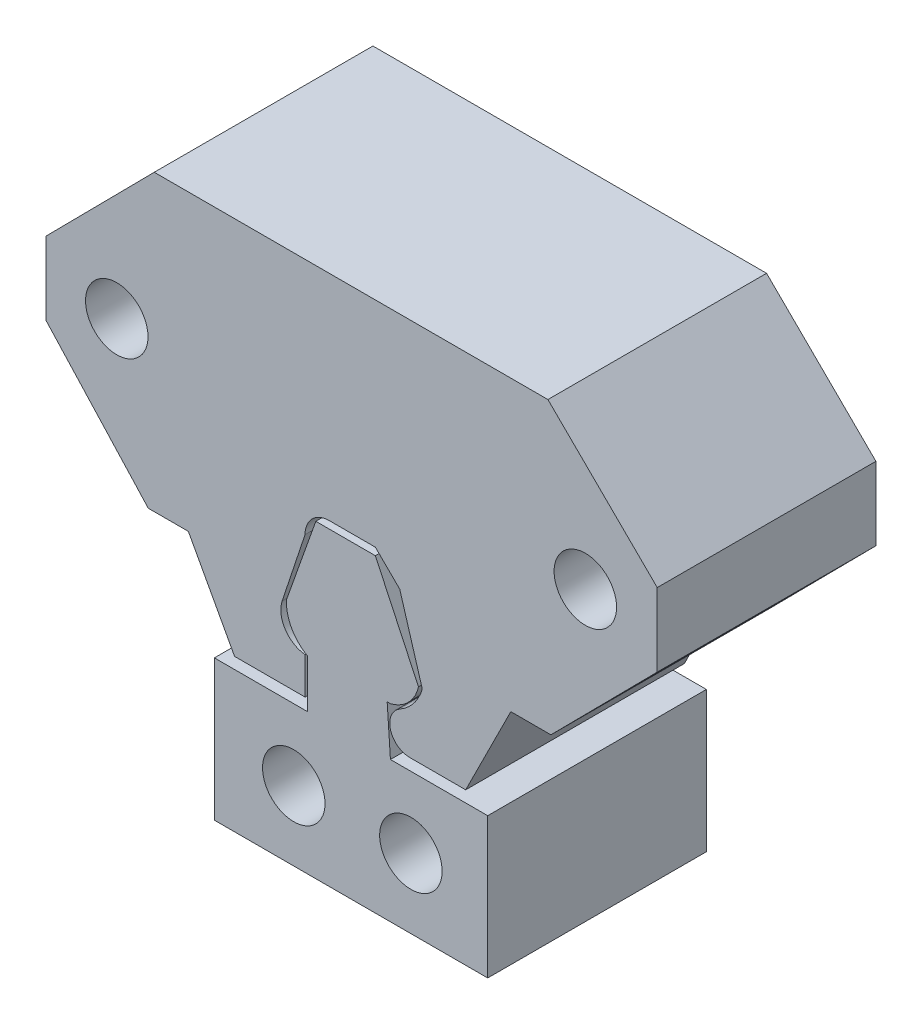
SolidWorks part; units mm, degrees
ref_plane "Front Plane" through (0, 0, 0) normal (0, 0, 1) x (1, 0, 0)
ref_plane "Top Plane" through (0, 0, 0) normal (0, 1, 0) x (1, 0, 0)
ref_plane "Right Plane" through (0, 0, 0) normal (1, 0, 0) x (0, 0, -1)
sketch "Sketch1" plane through (0, 0, 0) normal (0, 0, 1) x (1, 0, 0)
  line L0 (122.555, 198.3887) -> (200.555, 198.3887) construction
  line L1 (186.3841, 213.1351) -> (186.3841, 145.1351) construction
  line L3 (186.7465, 212.7767) -> (200.7465, 198.9271)
  line L4 (200.7465, 198.9271) -> (200.7465, 189.5559)
  line L5 (200.7465, 189.5559) -> (187.1301, 175.7916)
  line L6 (187.1301, 175.7916) -> (181.9968, 175.7916)
  line L7 (181.9968, 175.7916) -> (176.2207, 164.2339)
  line L8 (176.2207, 164.2339) -> (169.0289, 164.2339)
  line L9 (170.6634, 172.6244) -> (167.7718, 182.2703)
  line L10 (167.7718, 182.2703) -> (164.6535, 185.3551)
  line L11 (164.6535, 185.3551) -> (158.7543, 185.3551)
  line L12 (155.6512, 182.253) -> (152.7199, 173.4253)
  line L13 (154.2027, 164.2339) -> (146.6276, 164.2339)
  line L14 (146.6276, 164.2339) -> (140.7091, 175.1351)
  line L15 (155.6666, 168.9446) -> (155.6666, 164.2339)
  line L16 (155.6666, 162.7767) -> (144.0394, 162.7767)
  line L17 (144.0394, 162.7767) -> (144.0394, 144.7767)
  line L18 (144.0394, 144.7767) -> (179.0394, 144.7767)
  line L19 (179.0394, 144.7767) -> (179.0394, 162.7767)
  line L20 (179.0394, 162.7767) -> (166.582, 162.7767)
  line L21 (136.3402, 212.7767) -> (122.4906, 198.7767)
  line L22 (122.4906, 198.7767) -> (122.4906, 189.4054)
  line L23 (122.4906, 189.4054) -> (135.5757, 175.1351)
  line L24 (135.5757, 175.1351) -> (140.7091, 175.1351)
  line L25 (131.5394, 194.1351) -> (191.5394, 194.1351) construction
  line L27 (155.6666, 162.7767) -> (155.9626, 162.7767)
  line L29 (136.3402, 212.7767) -> (186.7465, 212.7767)
  line L30 (154.2027, 164.2339) -> (155.6666, 164.2339)
  line L31 (155.9626, 162.7767) -> (155.9626, 168.9446)
  line L32 (153.2635, 173.818) -> (157.026, 184.4131)
  line L33 (157.026, 184.4131) -> (164.6535, 184.4131)
  line L34 (164.6535, 184.4131) -> (170.1746, 172.6244)
  line L35 (166.582, 168.9633) -> (166.1647, 168.9633)
  line L36 (166.1647, 168.9633) -> (166.582, 162.7767)
  circle A0 centre (131.5394, 194.1351) radius 4
  arc A1 (169.0289, 164.2339) -> (167.7718, 168.9633) centre (169.0289, 166.7656) cw
  arc A2 (167.7718, 168.9633) -> (170.6634, 172.6244) centre (164.6707, 174.385) ccw
  arc A3 (158.7543, 185.3551) -> (155.6512, 182.253) centre (158.7543, 182.252) ccw
  arc A4 (152.7199, 173.4253) -> (155.6666, 168.9446) centre (155.9626, 172.3486) ccw
  circle A6 centre (191.5394, 194.1351) radius 4
  circle A7 centre (154.2027, 153.6868) radius 4
  circle A8 centre (169.2027, 153.6868) radius 4
  arc A9 (155.9626, 168.9446) -> (153.2635, 173.818) centre (158.6151, 173.5978) cw
  arc A10 (170.1746, 172.6244) -> (166.582, 168.9633) centre (165.3933, 173.723) cw
  point P42 (161.5394, 194.1351)
  point P43 (161.5394, 144.7767)
extrude "Boss-Extrude1" add sketch "Sketch1" along normal blind 28
